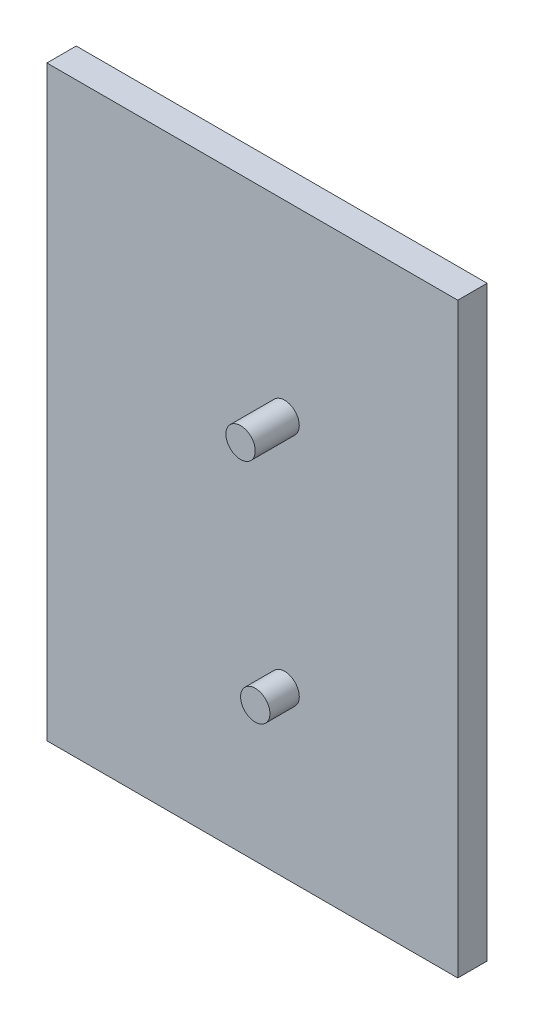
SolidWorks part; units mm, degrees
ref_plane "Front Plane" through (0, 0, 0) normal (0, 0, 1) x (1, 0, 0)
ref_plane "Top Plane" through (0, 0, 0) normal (0, 1, 0) x (1, 0, 0)
ref_plane "Right Plane" through (0, 0, 0) normal (1, 0, 0) x (0, 0, -1)
ref_plane "Plane1" through (0, 0, -62.5) normal (0, 0, 1) x (1, 0, 0)
sketch "Sketch1" plane through (0, 0, -62.5) normal (0, 0, 1) x (1, 0, 0)
  line L0 (-398, -277) -> (302, -277)
  line L1 (302, -277) -> (302, 723)
  line L2 (302, 723) -> (-398, 723)
  line L3 (-398, 723) -> (-398, -277)
  point P8 (-398, 498.5455)
extrude "Boss-Extrude1" add sketch "Sketch1" against normal blind 50
sketch "Sketch2" plane through (0, 0, -62.5) normal (0, 0, 1) x (1, 0, 0)
  line L0 (302, 723) -> (-398, 723) construction
  line L1 (302, -277) -> (302, 723) construction
  circle A0 centre (7, 403) radius 25
  dimension "D4" = 50
  dimension "D1" = 320
  dimension "D2" = 295
extrude "Boss-Extrude2" add sketch "Sketch2" along normal blind 75
sketch "Sketch3" plane through (0, 0, -62.5) normal (0, 0, 1) x (1, 0, 0)
  line L0 (302, -277) -> (302, 723) construction
  circle A0 centre (7, 3) radius 25
  dimension "D3" = 50
  dimension "D1" = 400
  dimension "D2" = 295
extrude "Boss-Extrude3" add sketch "Sketch3" along normal blind 50
